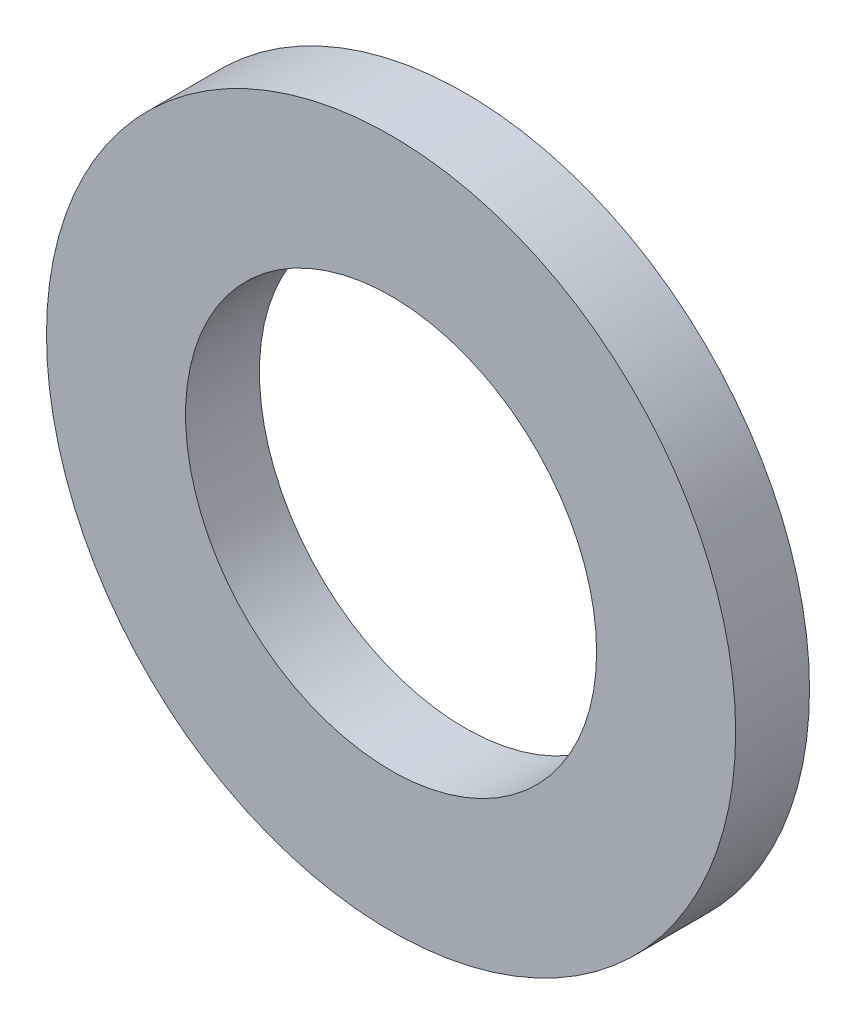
SolidWorks part; units mm, degrees
ref_plane "Face" through (0, 0, 0) normal (0, 0, 1) x (1, 0, 0)
ref_plane "Dessus" through (0, 0, 0) normal (0, 1, 0) x (1, 0, 0)
ref_plane "Droite" through (0, 0, 0) normal (1, 0, 0) x (0, 0, -1)
sketch "Esquisse1" plane through (0, 0, 0) normal (0, 0, 1) x (1, 0, 0)
  circle A0 centre (0, 0) radius 8.35 construction
  circle A1 centre (0, 0) radius 14
  circle A2 centre (0, 0) radius 14
  circle A3 centre (0, 0) radius 8.35
  dimension "D1" = 0
extrude "Base-Extrusion" add sketch "Esquisse1" along normal blind 3
